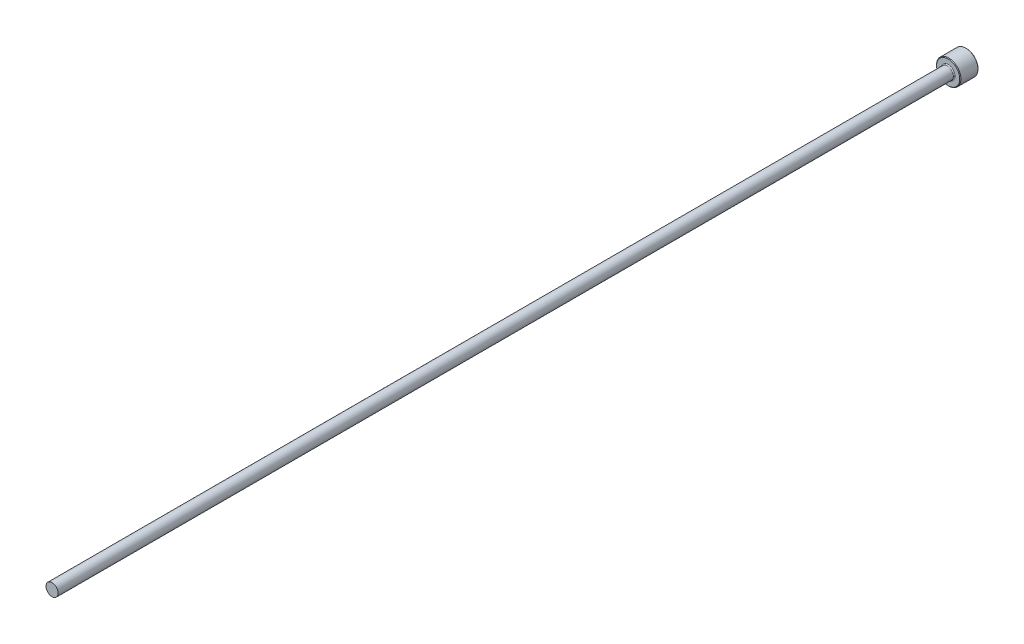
SolidWorks part; units mm, degrees
ref_plane "Front Plane" through (0, 0, 0) normal (0, 0, 1) x (1, 0, 0)
ref_plane "Top Plane" through (0, 0, 0) normal (0, 1, 0) x (1, 0, 0)
ref_plane "Right Plane" through (0, 0, 0) normal (1, 0, 0) x (0, 0, -1)
sketch "Sketch1" plane through (0, 0, 0) normal (1, 0, 0) x (0, 0, -1)
  line L0 (0, 0) -> (0, 4)
  line L1 (0, 4.4) -> (0, -4.4) construction
  line L2 (0, 4) -> (-6, 4)
  line L3 (-6, 4) -> (-6, 2.3)
  line L4 (-6.3, 2) -> (-300, 2)
  line L5 (-300, 2) -> (-300, 0)
  line L6 (4.4, 0) -> (-4.4, 0) construction
  line L7 (-300, 0) -> (0, 0)
  line L8 (-109.0506, 0) -> (16.9928, 0) construction
  arc A0 (-6, 2.3) -> (-6.3, 2) centre (-6.3, 2.3) cw
  dimension "D1" = 0.3
  dimension "D2" = 8
  dimension "D3" = 4
  dimension "D4" = 300
  dimension "D5" = 6
revolve "Revolve1" add sketch "Sketch1" angle 360 about L8
chamfer "Chamfer1" distance 0.2 angle 45 2 edges at (4, 0, 0) (4, 0, 6)
